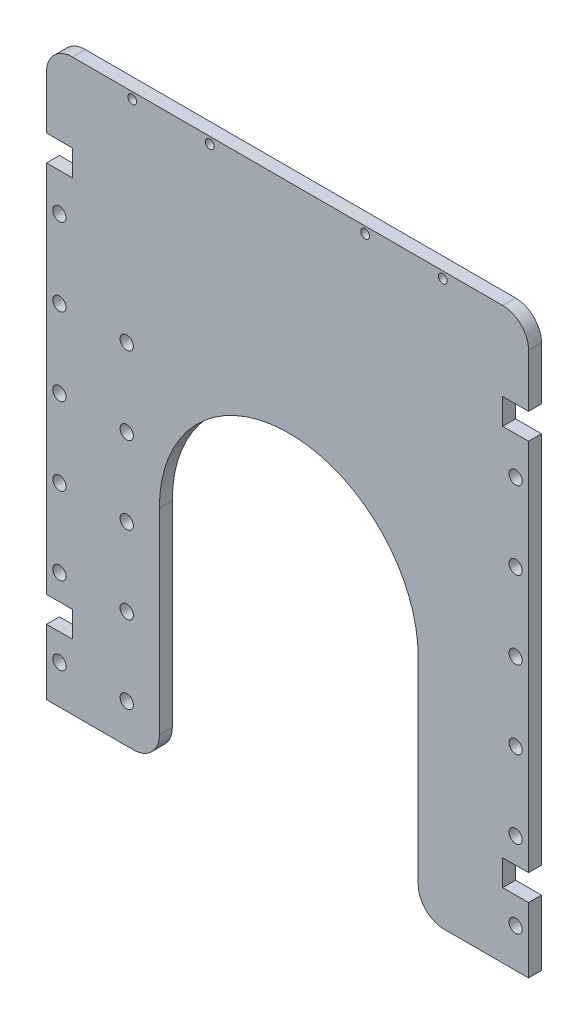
SolidWorks part; units mm, degrees
ref_plane "Front Plane" through (0, 0, 0) normal (0, 0, 1) x (1, 0, 0)
ref_plane "Top Plane" through (0, 0, 0) normal (0, 1, 0) x (1, 0, 0)
ref_plane "Right Plane" through (0, 0, 0) normal (1, 0, 0) x (0, 0, -1)
sketch "Sketch1" plane through (0, 0, 0) normal (0, 0, 1) x (1, 0, 0)
  line L0 (55.372, 0) -> (55.372, 109.22)
  line L1 (182.372, 109.22) -> (182.372, 0)
  line L8 (55.372, 0) -> (0, 0)
  line L9 (0, 0) -> (0, 279.4)
  line L11 (182.372, 0) -> (236.5, 0)
  line L12 (236.5, 0) -> (236.5, 279.4)
  line L13 (236.5, 279.4) -> (0, 279.4)
  arc A0 (55.372, 109.22) -> (118.872, 172.72) centre (118.872, 109.22) cw
  arc A1 (118.872, 172.72) -> (182.372, 109.22) centre (118.872, 109.22) cw
  dimension "D1" = 236.5
  dimension "D2" = 63.5
  dimension "D3" = 127
  dimension "D4" = 109.22
  dimension "D5" = 279.4
  dimension "D6" = 55.372
extrude "Boss-Extrude1" add sketch "Sketch1" against normal blind 6.35
fillet "Fillet1" radius 12.7 2 edges at (236.5, 279.4, -3.175) (0, 279.4, -3.175)
fillet "Fillet2" radius 12.7 2 edges at (182.372, 0, -3.175) (55.372, 0, -3.175)
sketch "Sketch2" plane through (0, 0, 0) normal (0, 0, 1) x (1, 0, 0)
  line L0 (236.5, 0) -> (223.8, 0) construction
  line L1 (230.15, 0) -> (230.15, 219.3279) construction
  line L2 (223.8, 219.3279) -> (236.5, 219.3279) construction
  line L3 (0, 266.7) -> (236.5, 266.7) construction
  line L4 (0, 266.7) -> (0, 0) construction
  line L5 (118.25, 266.7) -> (118.25, 233.1918) construction
  line L6 (6.35, 0) -> (6.35, 219.3279) construction
  line L7 (0, 0) -> (12.7, 0) construction
  circle A0 centre (230.15, 209.55) radius 3.25
  circle A1 centre (230.15, 171.45) radius 3.25
  circle A2 centre (230.15, 133.35) radius 3.25
  circle A3 centre (230.15, 95.25) radius 3.25
  circle A4 centre (230.15, 57.15) radius 3.25
  circle A5 centre (230.15, 19.05) radius 3.25
  circle A6 centre (6.35, 19.05) radius 3.25
  circle A7 centre (6.35, 57.15) radius 3.25
  circle A8 centre (6.35, 95.25) radius 3.25
  circle A9 centre (6.35, 133.35) radius 3.25
  circle A10 centre (6.35, 171.45) radius 3.25
  circle A11 centre (6.35, 209.55) radius 3.25
  dimension "D1" = 6.5
  dimension "D3" = 19.05
  dimension "D4" = 38.1
  dimension "D2" = 6
extrude "Cut-Extrude1" cut sketch "Sketch2" against normal through all
sketch "Sketch3" plane through (0, 0, 0) normal (0, 0, 1) x (1, 0, 0)
  line L0 (33.01, 0) -> (45.71, 0) construction
  line L1 (33.01, 0) -> (33.01, 15.8) construction
  line L2 (45.71, 177.8) -> (45.71, 136.6) construction
  line L3 (39.36, 0) -> (39.36, 117.9189) construction
  line L4 (0, 0) -> (42.672, 0) construction
  circle A0 centre (39.36, 19.05) radius 3.25
  circle A1 centre (39.36, 57.15) radius 3.25
  circle A2 centre (39.36, 95.25) radius 3.25
  circle A3 centre (39.36, 133.35) radius 3.25
  circle A4 centre (39.36, 171.45) radius 3.25
  dimension "D1" = 6.5
  dimension "D2" = 19.05
  dimension "D4" = 38.1
  dimension "D3" = 5
extrude "Cut-Extrude2" cut sketch "Sketch3" against normal through all
sketch "Sketch4" plane through (0, 0, 0) normal (0, 0, 1) x (1, 0, 0)
  line L0 (223.8, 279.4) -> (12.7, 279.4) construction
  line L1 (0, 266.7) -> (0, 0) construction
  line L2 (12.7, 240.74) -> (0, 240.74)
  line L3 (12.7, 240.74) -> (12.7, 228.04)
  line L4 (12.7, 228.04) -> (0, 228.04)
  line L5 (0, 0) -> (42.672, 0) construction
  line L6 (236.5, 0) -> (236.5, 266.7) construction
  line L7 (223.8, 228.04) -> (236.5, 228.04) construction
  line L8 (223.8, 240.74) -> (236.5, 240.74)
  line L9 (223.8, 240.74) -> (223.8, 228.04)
  line L10 (223.8, 228.04) -> (236.5, 228.04)
  line L12 (223.8, 32.04) -> (236.5, 32.04) construction
  line L13 (223.8, 44.74) -> (236.5, 44.74)
  line L14 (223.8, 44.74) -> (223.8, 32.04)
  line L15 (223.8, 32.04) -> (236.5, 32.04)
  line L16 (236.5, 44.74) -> (236.5, 32.04)
  line L17 (236.5, 240.74) -> (236.5, 228.04)
  line L18 (0, 240.74) -> (0, 228.04)
  line L21 (0, 44.74) -> (12.7, 44.74)
  line L22 (0, 44.74) -> (0, 32.04)
  line L23 (0, 32.04) -> (12.7, 32.04)
  line L24 (12.7, 44.74) -> (12.7, 32.04)
  dimension "D1" = 12.7
  dimension "D2" = 12.7
  dimension "D3" = 12.7
  dimension "D4" = 12.7
  dimension "D5" = 38.66
  dimension "D6" = 44.74
extrude "Cut-Extrude3" cut sketch "Sketch4" against normal blind 12.7
sketch "Sketch5" plane through (0, 0, 0) normal (0, 0, 1) x (1, 0, 0)
  line L0 (118.25, 279.4) -> (118.25, 263.0898) construction
  line L1 (223.8, 279.4) -> (12.7, 279.4) construction
  line L2 (118.25, 276.098) -> (226.1955, 276.098) construction
  circle A0 centre (194.45, 276.098) radius 2.15
  circle A1 centre (156.35, 276.098) radius 2.15
  circle A2 centre (42.05, 276.098) radius 2.15
  circle A3 centre (80.15, 276.098) radius 2.15
  dimension "D2" = 4.3
  dimension "D1" = 3.302
  dimension "D3" = 38.1
  dimension "D4" = 76.2
extrude "Cut-Extrude4" cut sketch "Sketch5" against normal through all
